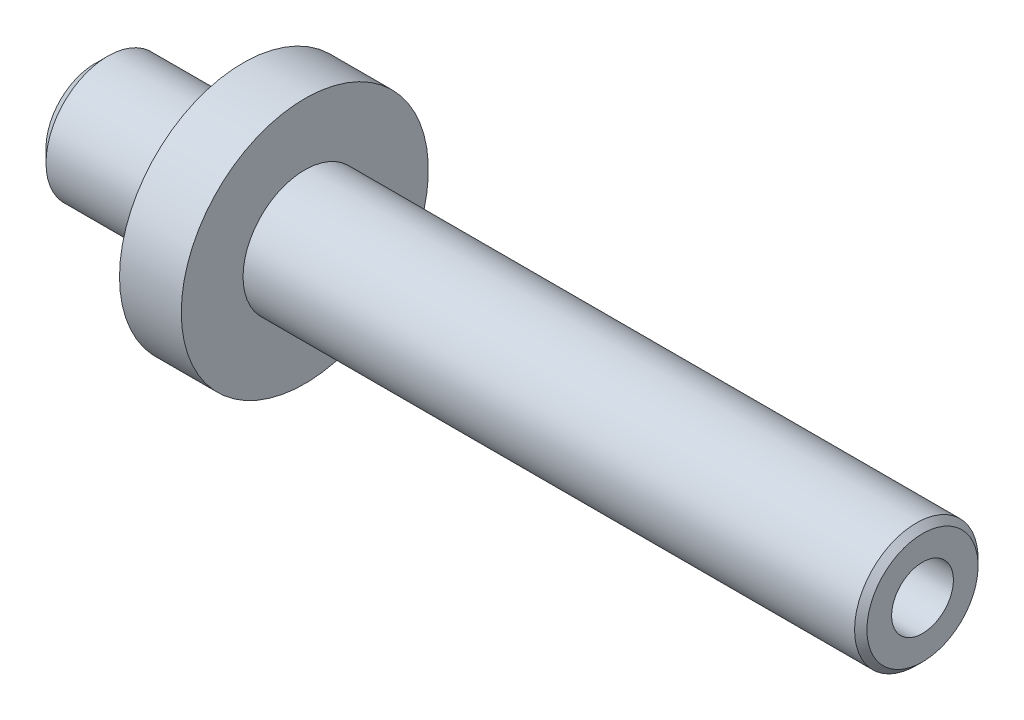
SolidWorks part; units mm, degrees
ref_plane "Plan de face" through (0, 0, 0) normal (0, 0, 1) x (1, 0, 0)
ref_plane "Plan de dessus" through (0, 0, 0) normal (0, 1, 0) x (1, 0, 0)
ref_plane "Plan de droite" through (0, 0, 0) normal (1, 0, 0) x (0, 0, -1)
sketch "Esquisse1" plane through (0, 0, 0) normal (0, 0, 1) x (1, 0, 0)
  line L0 (-65.4543, 0) -> (59.6305, 0) construction
  line L1 (-53.3003, 0) -> (-53.3003, 5)
  line L2 (-53.3003, 5) -> (-41.3003, 5)
  line L5 (-41.3003, 5) -> (-41.3003, 10)
  line L6 (-41.3003, 10) -> (-36.3003, 10)
  line L7 (-36.3003, 10) -> (-36.3003, 5)
  line L8 (-36.3003, 5) -> (13.6997, 5)
  line L9 (13.6997, 5) -> (13.6997, 0)
  line L12 (13.6997, 0) -> (-53.3003, 0)
  dimension "D1" = 10
  dimension "D2" = 10
  dimension "D4" = 20
  dimension "D5" = 50
  dimension "D6" = 5
  dimension "D7" = 12
revolve "Révolution1" add sketch "Esquisse1" angle 360 about L0
chamfer "Chanfrein1" distance 1.05 angle 45 1 edges at (-53.3003, 0, 5)
chamfer "Chanfrein2" distance 0.5 angle 45 1 edges at (13.6997, 0, 5)
hole_wizard "Trou taraudé M61" positions "Esquisse3" profile "Esquisse2" tap size "M6" standard "ISO"
sketch "Esquisse3" plane through (13.6997, 0, 0) normal (1, 0, 0) x (0, 0, -1)
  circle A0 centre (0, 0) radius 4.5 construction
  point P0 (0, 0)
sketch "Esquisse2" plane through (13.6997, 0, 0) normal (0, 1, 0) x (0, 0, -1)
  line L0 (0, 0) -> (0, 18.5022)
  line L1 (0, 18.5022) -> (2.5, 17)
  line L2 (2.5, 17) -> (2.5, 0)
  line L5 (2.5, 0) -> (0, 0)
  line L10 (0, 18.5022) -> (-2.5, 17) construction
  line L11 (0, -6.35) -> (0, 107.95) construction
  dimension "Diamètre du trou pour taraudage" = 5
  dimension "Profondeur du trou pour taraudage" = 17
  dimension "Angle de pointe" = 118
